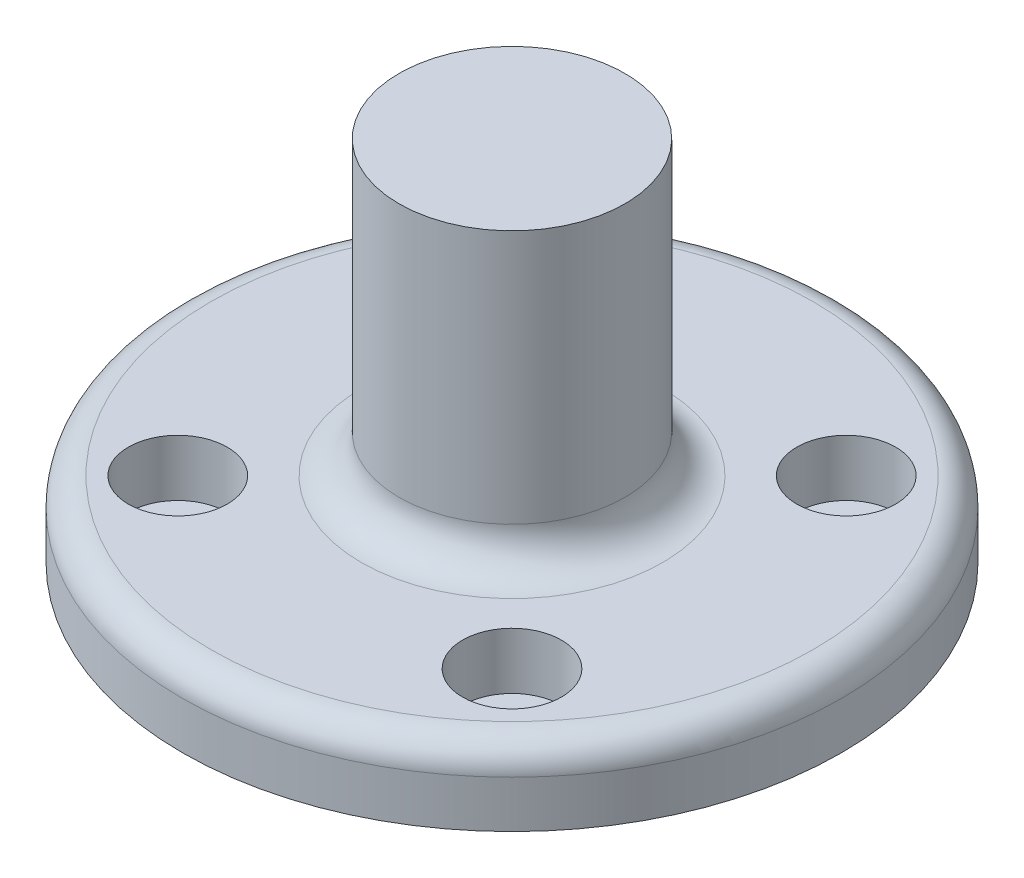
SolidWorks part; units mm, degrees
ref_plane "Front Plane" through (0, 0, 0) normal (0, 0, 1) x (1, 0, 0)
ref_plane "Top Plane" through (0, 0, 0) normal (0, 1, 0) x (1, 0, 0)
ref_plane "Right Plane" through (0, 0, 0) normal (1, 0, 0) x (0, 0, -1)
sketch "Sketch1" plane through (0, 0, 0) normal (0, 1, 0) x (1, 0, 0)
  circle A0 centre (0, 0) radius 35
  dimension "D1" = 70
extrude "Boss-Extrude1" add sketch "Sketch1" along normal blind 8
sketch "Sketch2" plane through (0, 8, 0) normal (0, 1, 0) x (1, 0, 0)
  circle A0 centre (-17.75, 17.75) radius 5.25
  circle A1 centre (17.75, 17.75) radius 5.25
  circle A2 centre (17.75, -17.75) radius 5.25
  circle A3 centre (-17.75, -17.75) radius 5.25
extrude "Cut-Extrude1" cut sketch "Sketch2" against normal blind 6
sketch "Sketch3" plane through (0, 2, 0) normal (0, 1, 0) x (1, 0, 0)
  circle A0 centre (17.75, 17.75) radius 3.25
  circle A1 centre (-17.75, 17.75) radius 3.25
  circle A2 centre (-17.75, -17.75) radius 3.25
  circle A3 centre (17.75, -17.75) radius 3.25
  dimension "D1" = 6.5
extrude "Cut-Extrude2" cut sketch "Sketch3" against normal blind 2
sketch "Sketch4" plane through (0, 0, 0) normal (0, 0, 1) x (1, 0, 0)
  line L1 (35, 8) -> (-35, 8) construction
  line L2 (0, 39) -> (0, 8)
  line L3 (12, 8) -> (0, 8)
  line L4 (12, 39) -> (0, 39)
  line L5 (12, 8) -> (12, 39)
  dimension "D1" = 12
  dimension "D3" = 31
revolve "Revolve1" add sketch "Sketch4" angle 360 about L2
fillet "Fillet1" radius 3 1 edges at (0, 8, 35)
fillet "Fillet2" radius 4 1 edges at (0, 8, 12)
equation "\"D5@Sketch2\"=\"D4@Sketch2\"/2"
equation "\"D3@Sketch2\"=\"D2@Sketch2\"/2"
equation "\"D9@Sketch2\"=\"D8@Sketch2\"/2"
equation "\"D7@Sketch2\"=\"D6@Sketch2\"/2"
